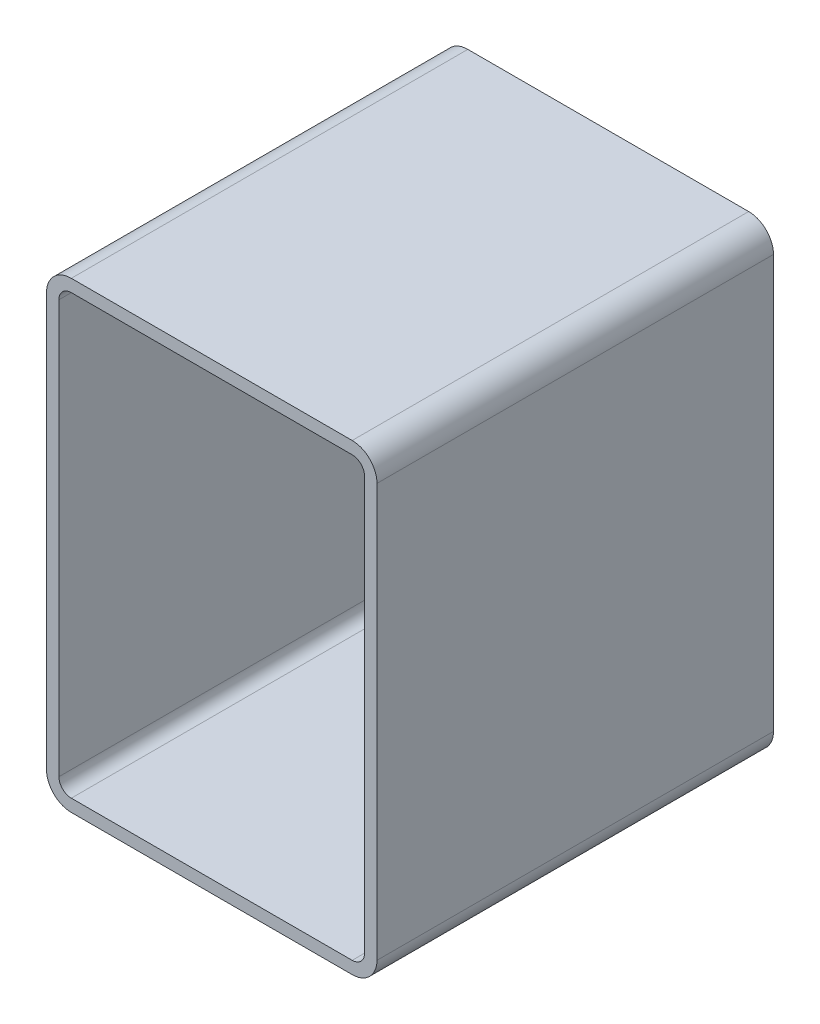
SolidWorks part; units mm, degrees
ref_plane "Front Plane" through (0, 0, 0) normal (0, 0, 1) x (1, 0, 0)
ref_plane "Top Plane" through (0, 0, 0) normal (0, 1, 0) x (1, 0, 0)
ref_plane "Right Plane" through (0, 0, 0) normal (1, 0, 0) x (0, 0, -1)
sketch "Sketch1" plane through (0, 0, 0) normal (0, 0, 1) x (1, 0, 0)
sketch_block_instance "HSS14x10x0.375-1"
sketch_block "HSS14x10x0.375"
extrude "Boss-Extrude1" add sketch "Sketch1" along normal blind 304.8
